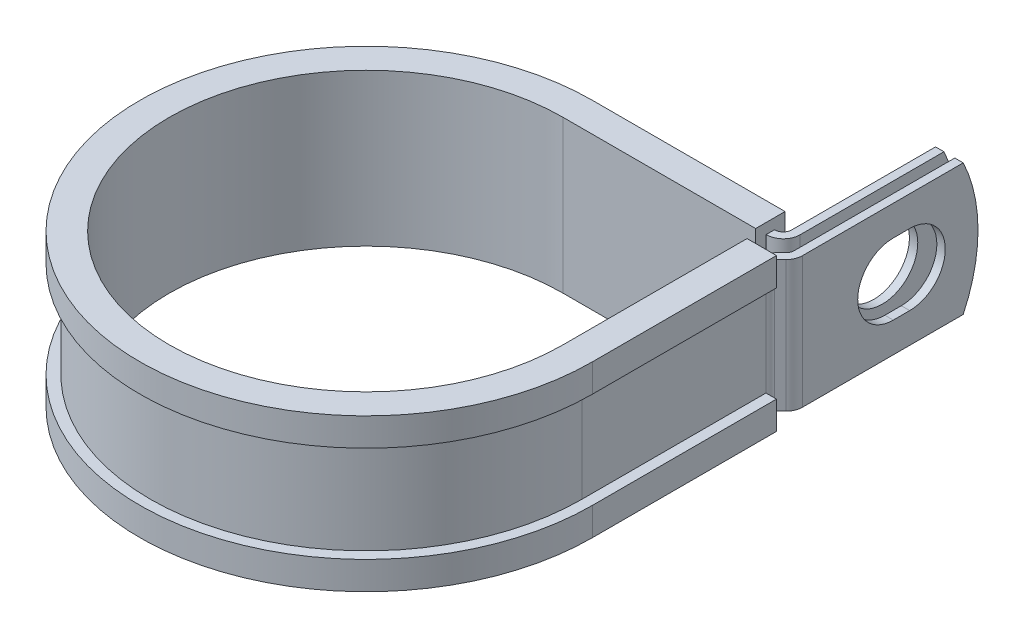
SolidWorks part; units mm, degrees
ref_plane "Front Plane" through (0, 0, 0) normal (0, 0, 1) x (1, 0, 0)
ref_plane "Top Plane" through (0, 0, 0) normal (0, 1, 0) x (1, 0, 0)
ref_plane "Right Plane" through (0, 0, 0) normal (1, 0, 0) x (0, 0, -1)
sketch "Sketch1" plane through (0, 0, 0) normal (0, 1, 0) x (1, 0, 0)
  line L0 (0, 30.099) -> (27.9833, 30.099)
  line L1 (30.099, 0) -> (30.099, 26.6865)
  line L2 (30.4217, 55.5498) -> (30.4217, 32.5374)
  line L3 (30.8132, 28.4107) -> (31.6394, 29.2369)
  line L5 (31.9965, 30.099) -> (31.9965, 55.5498)
  arc A0 (0, 30.099) -> (30.099, 0) centre (0, 0) ccw
  arc A1 (30.8132, 28.4107) -> (30.099, 26.6865) centre (32.5374, 26.6865) ccw
  arc A2 (31.6394, 29.2369) -> (31.9965, 30.099) centre (30.7773, 30.099) ccw
  arc A3 (27.9833, 30.099) -> (30.4217, 32.5374) centre (27.9833, 32.5374) ccw
extrude "Extrude-Thin1" add sketch "Sketch1" along normal mid plane 19.05 thin
sketch "Sketch2" plane through (29.2025, 0, 0) normal (-1, 0, 0) x (0, 0, 1)
  line L0 (-55.5498, 9.525) -> (-55.5498, -9.525) construction
  line L1 (0, 9.525) -> (0, -9.525) construction
  circle A0 centre (-44.45, 0) radius 5.1562
  point P2 (-55.5498, 0)
extrude "Cut-Extrude1" cut sketch "Sketch2" against normal up to surface (1.2192 mm away)
sketch "Sketch3" plane through (33.2157, 0, 0) normal (1, 0, 0) x (0, 0, -1)
  line L0 (43.2562, 0) -> (45.6438, 0) construction
  line L1 (43.2562, 5.1562) -> (45.6438, 5.1562)
  line L2 (43.2562, -5.1562) -> (45.6438, -5.1562)
  line L3 (55.5498, 9.525) -> (55.5498, -9.525) construction
  arc A0 (43.2562, 5.1562) -> (43.2562, -5.1562) centre (43.2562, 0) ccw
  arc A1 (45.6438, -5.1562) -> (45.6438, 5.1562) centre (45.6438, 0) ccw
  point P3 (44.45, 0)
  point P8 (55.5498, 0)
  point P11 (38.1, 0)
  point P12 (50.8, 0)
extrude "Cut-Extrude2" cut sketch "Sketch3" against normal up to surface (1.2192 mm away)
sketch "Sketch4" plane through (29.2025, 0, 0) normal (-1, 0, 0) x (0, 0, 1)
  line L0 (-55.5498, 9.525) -> (-55.5498, -9.525)
  line L1 (-55.5498, 9.525) -> (-53.4053, 9.525)
  line L2 (-55.5498, 9.525) -> (-32.5374, 9.525) construction
  line L3 (-55.5498, -9.525) -> (-53.4053, -9.525)
  line L4 (-55.5498, -9.525) -> (-32.5374, -9.525) construction
  arc A0 (-53.4053, 9.525) -> (-53.4053, -9.525) centre (-33.3248, 0) ccw
extrude "Cut-Extrude3" cut sketch "Sketch4" against normal through all contours A0 M4 M5 | A0 L0 M2
ref_plane "Plane1" through (0, 0, -26.6865) normal (0, 0, -1) x (-1, 0, 0)
ref_plane "Plane2" through (27.9325, 0, 0) normal (-1, 0, 0) x (0, 0, 1)
sketch "Sketch5" plane through (0, 0, -26.6865) normal (0, 0, -1) x (-1, 0, 0)
  line L0 (-31.3182, 9.525) -> (-30.099, 9.525)
  line L1 (-31.3182, 9.525) -> (-31.3182, -9.525) construction
  line L3 (-30.099, 9.525) -> (-30.099, -9.525)
  line L4 (-30.099, -9.525) -> (-31.3182, -9.525)
  line L5 (-31.3182, -9.525) -> (-31.3182, -6.985)
  line L6 (-31.3182, 9.525) -> (-31.3182, 6.985)
  line L7 (-32.8422, 11.049) -> (-32.8422, 6.985)
  line L8 (-32.8422, 11.049) -> (-28.575, 11.049)
  line L9 (-28.575, 11.049) -> (-28.575, -11.049)
  line L10 (-28.575, -11.049) -> (-32.8422, -11.049)
  line L11 (-32.8422, -11.049) -> (-32.8422, -6.985)
  line L12 (-32.8422, 6.985) -> (-31.3182, 6.985)
  line L13 (-31.3182, -6.985) -> (-32.8422, -6.985)
sketch "Sketch6" plane through (0, 9.525, 0) normal (0, 1, 0) x (1, 0, 0)
  line L0 (28.575, 0) -> (28.575, 26.6865)
  line L1 (28.575, 26.6865) -> (32.8422, 26.6865) construction
  line L2 (27.9325, 6.9878) -> (27.9325, -6.9878) construction
  line L5 (0, 28.575) -> (27.9325, 28.575)
  arc A0 (0, 28.575) -> (28.575, 0) centre (0, 0) ccw
sweep "Sweep1" add profiles "Sketch5" path "Sketch6"
equation "\"D4@Sketch5\" = \"D1@Extrude-Thin1\""
equation "\"D5@Sketch5\" = \"D5@Extrude-Thin1\""
equation "\"D1@Sketch3\" = \"D2@Sketch2\""
equation "\"D7@Sketch1\" = \"D3@Sketch2\" + \"D1@Sketch3\""
equation "\"D1@Sketch1\" = \"D1@Sketch6\" + 2 * \"D3@Sketch5\""
equation "\"D1@Sketch4\" = ( \"D1@Extrude-Thin1\" + .125 ) * 2"
equation "\"D9@Sketch1\"= \"D5@Extrude-Thin1\""
equation "\"D8@Sketch1\"= 2 * \"D5@Extrude-Thin1\""
equation "\"D2@Sketch1\" = 2 * \"D5@Extrude-Thin1\""
equation "\"D2@Sketch3\" = \"D1@Sketch2\""
